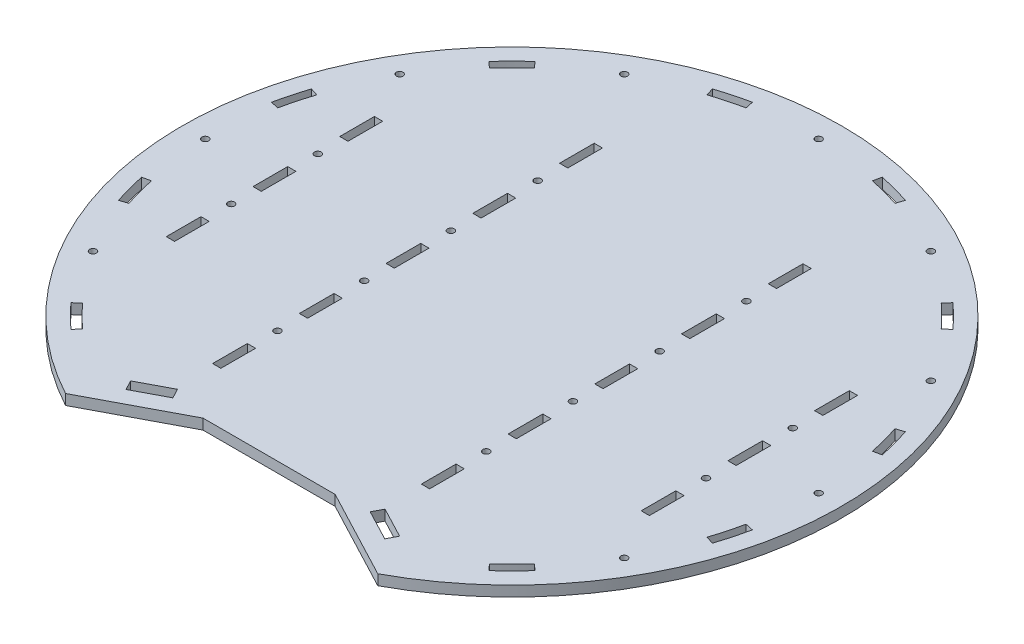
SolidWorks part; units mm, degrees
ref_plane "Front Plane" through (0, 0, 0) normal (0, 0, 1) x (1, 0, 0)
ref_plane "Top Plane" through (0, 0, 0) normal (0, 1, 0) x (1, 0, 0)
ref_plane "Right Plane" through (0, 0, 0) normal (1, 0, 0) x (0, 0, -1)
sketch "Sketch1" plane through (0, 0, 0) normal (0, 1, 0) x (1, 0, 0)
  line L0 (-106.3364, -157.4566) -> (-42.1421, -123.65) construction
  line L17 (-42.1421, -123.65) -> (42.1421, -123.65) construction
  line L18 (0, 190) -> (0, -190) construction
  line L19 (-136.88, -10) -> (-136.88, -40) construction
  line L20 (-190, 0) -> (190, 0) construction
  line L33 (139.26, -40) -> (139.26, -60)
  line L34 (-134.5, 40) -> (-139.26, 40)
  line L35 (-134.5, 40) -> (-134.5, 60)
  line L36 (-134.5, 60) -> (-139.26, 60)
  line L37 (-139.26, 40) -> (-139.26, 60)
  line L38 (-134.5, 10) -> (-139.26, 10)
  line L39 (-134.5, 10) -> (-134.5, -10)
  line L40 (-134.5, -10) -> (-139.26, -10)
  line L41 (-139.26, 10) -> (-139.26, -10)
  line L46 (-134.5, -40) -> (-139.26, -40)
  line L47 (-134.5, -40) -> (-134.5, -60)
  line L48 (-134.5, -60) -> (-139.26, -60)
  line L49 (-139.26, -40) -> (-139.26, -60)
  line L50 (134.5, -60) -> (139.26, -60)
  line L51 (134.5, -40) -> (134.5, -60)
  line L52 (134.5, -40) -> (139.26, -40)
  line L53 (139.26, 10) -> (139.26, -10)
  line L54 (134.5, -10) -> (139.26, -10)
  line L55 (134.5, 10) -> (134.5, -10)
  line L56 (134.5, 10) -> (139.26, 10)
  line L57 (139.26, 40) -> (139.26, 60)
  line L58 (134.5, 60) -> (139.26, 60)
  line L59 (134.5, 40) -> (134.5, 60)
  line L60 (134.5, 40) -> (139.26, 40)
  line L73 (42.1421, -123.65) -> (106.3364, -157.4566) construction
  line L86 (0, 0) -> (-37.4241, 176.0666) construction
  line L99 (-155.3051, -190) -> (147.1552, -190) construction
  line L100 (-128.4523, -140) -> (128.4523, -140) construction
  line L101 (-90, -167.332) -> (-38.1, -140)
  line L102 (-38.1, -140) -> (38.1, -140)
  line L103 (38.1, -140) -> (90, -167.332)
  line L104 (-54.1521, 166.6631) -> (-55.6231, 171.1902)
  line L105 (0, 0) -> (-55.6231, 171.1902) construction
  line L126 (-136.88, 10) -> (-136.88, 40) construction
  line L127 (-37.4241, 176.0666) -> (-36.4344, 171.4106)
  line L128 (-100.2255, -161.4151) -> (-40.5722, -130) construction
  line L129 (-120.4435, 133.7661) -> (-117.2584, 130.2287)
  line L130 (-40.5722, -130) -> (40.5722, -130) construction
  line L131 (40.5722, -130) -> (100.2255, -161.4151) construction
  line L132 (-130.2287, 117.2584) -> (-133.7661, 120.4435)
  line L133 (-171.1902, 55.6231) -> (-166.6631, 54.1521)
  line L134 (-171.4106, 36.4344) -> (-176.0666, 37.4241)
  line L135 (-176.0666, -37.4241) -> (-171.4106, -36.4344)
  line L136 (-166.6631, -54.1521) -> (-171.1902, -55.6231)
  line L137 (-133.7661, -120.4435) -> (-130.2287, -117.2584)
  line L138 (-117.2584, -130.2287) -> (-120.4435, -133.7661)
  line L139 (0, 0) -> (-36.4344, 171.4106) construction
  line L140 (57.7933, -10) -> (62.5533, -10)
  line L141 (117.2584, -130.2287) -> (120.4435, -133.7661)
  line L142 (133.7661, -120.4435) -> (130.2287, -117.2584)
  line L143 (166.6631, -54.1521) -> (171.1902, -55.6231)
  line L144 (176.0666, -37.4241) -> (171.4106, -36.4344)
  line L145 (171.4106, 36.4344) -> (176.0666, 37.4241)
  line L146 (171.1902, 55.6231) -> (166.6631, 54.1521)
  line L147 (130.2287, 117.2584) -> (133.7661, 120.4435)
  line L148 (120.4435, 133.7661) -> (117.2584, 130.2287)
  line L149 (37.4241, 176.0666) -> (36.4344, 171.4106)
  line L150 (54.1521, 166.6631) -> (55.6231, 171.1902)
  line L151 (-56.8793, -138.5878) -> (-59.8381, -132.9693)
  line L152 (-59.8381, -132.9693) -> (-77.5342, -142.2885)
  line L153 (-77.5342, -142.2885) -> (-74.5754, -147.907)
  line L154 (-74.5754, -147.907) -> (-56.8793, -138.5878)
  line L155 (77.5342, -142.2885) -> (74.5754, -147.907)
  line L156 (74.5754, -147.907) -> (56.8793, -138.5878)
  line L157 (56.8793, -138.5878) -> (59.8381, -132.9693)
  line L158 (59.8381, -132.9693) -> (77.5342, -142.2885)
  line L159 (-62.5533, 40) -> (-57.7933, 40)
  line L164 (-57.7933, 10) -> (-62.5533, 10)
  line L165 (-57.7933, 10) -> (-57.7933, -10)
  line L166 (-57.7933, -10) -> (-62.5533, -10)
  line L167 (-62.5533, 10) -> (-62.5533, -10)
  line L168 (-62.5533, 40) -> (-62.5533, 60)
  line L169 (-62.5533, 60) -> (-57.7933, 60)
  line L170 (-57.7933, 40) -> (-57.7933, 60)
  line L171 (-62.5533, 90) -> (-57.7933, 90)
  line L172 (-62.5533, 90) -> (-62.5533, 110)
  line L173 (-62.5533, 110) -> (-57.7933, 110)
  line L174 (-57.7933, 90) -> (-57.7933, 110)
  line L175 (-62.5533, -40) -> (-57.7933, -40)
  line L176 (-62.5533, -40) -> (-62.5533, -60)
  line L177 (-62.5533, -60) -> (-57.7933, -60)
  line L178 (-57.7933, -40) -> (-57.7933, -60)
  line L179 (-62.5533, -90) -> (-57.7933, -90)
  line L180 (-62.5533, -90) -> (-62.5533, -110)
  line L181 (-62.5533, -110) -> (-57.7933, -110)
  line L182 (-57.7933, -90) -> (-57.7933, -110)
  line L183 (62.5533, -60) -> (57.7933, -60)
  line L184 (57.7933, -40) -> (57.7933, -60)
  line L185 (62.5533, -40) -> (62.5533, -60)
  line L186 (62.5533, -40) -> (57.7933, -40)
  line L187 (62.5533, -110) -> (57.7933, -110)
  line L188 (62.5533, -90) -> (57.7933, -90)
  line L189 (57.7933, -90) -> (57.7933, -110)
  line L190 (62.5533, -90) -> (62.5533, -110)
  line L191 (57.7933, 90) -> (57.7933, 110)
  line L192 (62.5533, 110) -> (57.7933, 110)
  line L193 (62.5533, 90) -> (62.5533, 110)
  line L194 (62.5533, 90) -> (57.7933, 90)
  line L195 (57.7933, 40) -> (57.7933, 60)
  line L196 (62.5533, 60) -> (57.7933, 60)
  line L197 (62.5533, 40) -> (62.5533, 60)
  line L198 (62.5533, 10) -> (62.5533, -10)
  line L199 (57.7933, 10) -> (57.7933, -10)
  line L200 (57.7933, 10) -> (62.5533, 10)
  line L201 (62.5533, 40) -> (57.7933, 40)
  line L202 (-60.1733, 40) -> (-60.1733, 10) construction
  line L203 (-60.1733, -10) -> (-60.1733, -40) construction
  line L204 (-60.1733, 90) -> (-60.1733, 60) construction
  line L205 (-60.1733, -60) -> (-60.1733, -90) construction
  line L206 (0, 180) -> (0, 173.6114) construction
  line L207 (0, 0) -> (0, 176.8057) construction
  line L208 (0, 0) -> (-88.4029, 153.1182) construction
  circle A0 centre (0, 0) radius 190 construction
  arc A3 (-90, -167.332) -> (90, -167.332) centre (0, 0) cw
  circle A16 centre (0, 0) radius 180 construction
  circle A17 centre (0, 0) radius 175.24 construction
  arc A18 (-55.6231, 171.1902) -> (-37.4241, 176.0666) centre (0, 0) cw
  arc A19 (-54.1521, 166.6631) -> (-36.4344, 171.4106) centre (0, 0) cw
  arc A20 (-133.7661, 120.4435) -> (-120.4435, 133.7661) centre (0, 0) cw
  arc A21 (-130.2287, 117.2584) -> (-117.2584, 130.2287) centre (0, 0) cw
  arc A22 (-176.0666, 37.4241) -> (-171.1902, 55.6231) centre (0, 0) cw
  arc A23 (-171.4106, 36.4344) -> (-166.6631, 54.1521) centre (0, 0) cw
  arc A24 (-171.1902, -55.6231) -> (-176.0666, -37.4241) centre (0, 0) cw
  arc A25 (-166.6631, -54.1521) -> (-171.4106, -36.4344) centre (0, 0) cw
  arc A26 (-120.4435, -133.7661) -> (-133.7661, -120.4435) centre (0, 0) cw
  arc A27 (-117.2584, -130.2287) -> (-130.2287, -117.2584) centre (0, 0) cw
  arc A28 (120.4435, -133.7661) -> (133.7661, -120.4435) centre (0, 0) ccw
  arc A29 (117.2584, -130.2287) -> (130.2287, -117.2584) centre (0, 0) ccw
  arc A30 (166.6631, -54.1521) -> (171.4106, -36.4344) centre (0, 0) ccw
  arc A31 (171.1902, -55.6231) -> (176.0666, -37.4241) centre (0, 0) ccw
  arc A32 (176.0666, 37.4241) -> (171.1902, 55.6231) centre (0, 0) ccw
  arc A33 (171.4106, 36.4344) -> (166.6631, 54.1521) centre (0, 0) ccw
  arc A34 (133.7661, 120.4435) -> (120.4435, 133.7661) centre (0, 0) ccw
  arc A35 (130.2287, 117.2584) -> (117.2584, 130.2287) centre (0, 0) ccw
  arc A36 (54.1521, 166.6631) -> (36.4344, 171.4106) centre (0, 0) ccw
  arc A37 (55.6231, 171.1902) -> (37.4241, 176.0666) centre (0, 0) ccw
  circle A38 centre (-136.88, 25) radius 1.9558
  circle A39 centre (-136.88, -25) radius 1.9558
  circle A40 centre (-60.1733, -25) radius 1.9558
  circle A41 centre (-60.1733, -75) radius 1.9558
  circle A42 centre (-60.1733, 25) radius 1.9558
  circle A43 centre (-60.1733, 75) radius 1.9558
  circle A44 centre (0, 176.8057) radius 1.9558
  circle A45 centre (-88.4029, 153.1182) radius 1.9558
  circle A46 centre (-153.1182, 88.4029) radius 1.9558
  circle A47 centre (-176.8057, 0) radius 1.9558
  circle A48 centre (-153.1182, -88.4029) radius 1.9558
  circle A49 centre (88.4029, 153.1182) radius 1.9558
  circle A50 centre (60.1733, -75) radius 1.9558
  circle A51 centre (153.1182, -88.4029) radius 1.9558
  circle A52 centre (176.8057, 0) radius 1.9558
  circle A53 centre (153.1182, 88.4029) radius 1.9558
  circle A54 centre (136.88, -25) radius 1.9558
  circle A55 centre (60.1733, -25) radius 1.9558
  circle A56 centre (60.1733, 25) radius 1.9558
  circle A57 centre (136.88, 25) radius 1.9558
  circle A58 centre (60.1733, 75) radius 1.9558
  point P71 (-60.1733, 90)
  point P116 (0, -140)
  point P199 (-57.7933, 0)
  dimension "D1" = 380
  dimension "D5" = 3.9116
  dimension "D30" = 360
  dimension "D31" = 350.48
  dimension "D38" = 20
  dimension "D6" = 4.76
  dimension "D7" = 71.9467
  dimension "D8" = 20
  dimension "D9" = 30
  dimension "D10" = 30
  dimension "D11" = 30
  dimension "D12" = 5
  dimension "D13" = 30
  dimension "D16" = 6.35
  dimension "D17" = 50
  dimension "D18" = 76.2
  dimension "D19" = 6.35
  dimension "D20" = 6.35
  dimension "D21" = 30
  dimension "D22" = 30
  dimension "D28" = 6
  dimension "D29" = 12
  dimension "D32" = 10
  dimension "D33" = 10
  dimension "D34" = 10
  dimension "D35" = 5
  dimension "D39" = 20
  dimension "D41" = 20
extrude "Boss-Extrude1" add sketch "Sketch1" along normal blind 6
